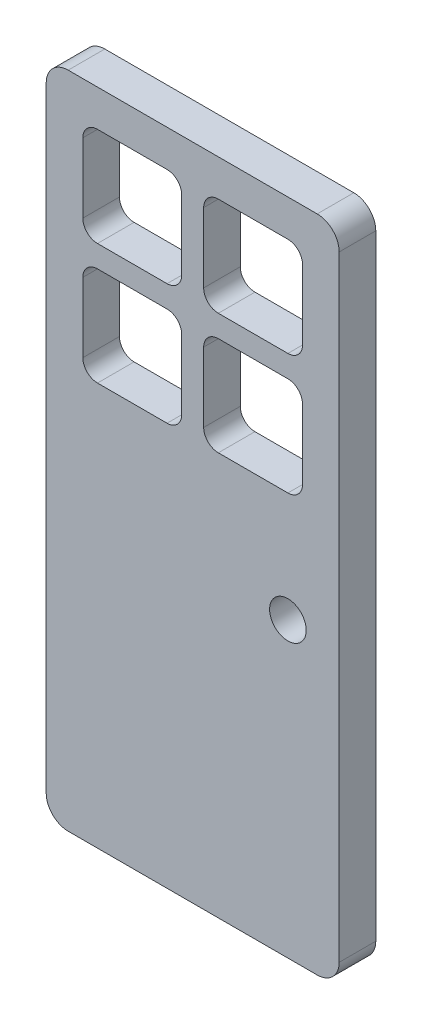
SolidWorks part; units mm, degrees
ref_plane "Front Plane" through (0, 0, 0) normal (0, 0, 1) x (1, 0, 0)
ref_plane "Top Plane" through (0, 0, 0) normal (0, 1, 0) x (1, 0, 0)
ref_plane "Right Plane" through (0, 0, 0) normal (1, 0, 0) x (0, 0, -1)
sketch "Sketch1" plane through (0, 0, 0) normal (0, 0, 1) x (1, 0, 0)
  line L1 (20, -45) -> (-20, -45)
  line L2 (20, -45) -> (20, 45)
  line L3 (20, 45) -> (-20, 45)
  line L4 (-20, -45) -> (-20, 45)
  line L5 (20, -45) -> (-20, 45) construction
  line L6 (20, 45) -> (-20, -45) construction
  point P0 (0, 0)
  dimension "D1" = 90
  dimension "D2" = 40
extrude "Boss-Extrude1" add sketch "Sketch1" along normal mid plane 5
fillet "Fillet1" radius 3 4 edges at (-20, -45, 0) (20, -45, 0) (20, 45, 0) (-20, 45, 0)
sketch "Sketch2" plane through (0, 0, 2.5) normal (0, 0, 1) x (1, 0, 0)
  line L0 (17, 45) -> (-17, 45) construction
  line L1 (15, 10) -> (-15, 10)
  line L2 (15, 10) -> (15, 40)
  line L3 (15, 40) -> (-15, 40)
  line L4 (-15, 10) -> (-15, 40)
  line L5 (15, 10) -> (-15, 40) construction
  line L6 (15, 40) -> (-15, 10) construction
  line L7 (-20, 42) -> (-20, -42) construction
  line L9 (0, 25) -> (0, 0) construction
  point P0 (0, 25)
  dimension "D1" = 5
  dimension "D2" = 5
  dimension "D3" = 30
extrude "Cut-Extrude1" cut sketch "Sketch2" against normal through all
sketch "Sketch3" plane through (0, 0, 2.5) normal (0, 0, 1) x (1, 0, 0)
  line L1 (15, 40) -> (-15, 40) construction
  line L2 (1.5, 10) -> (-1.5, 10)
  line L3 (1.5, 10) -> (1.5, 40)
  line L4 (1.5, 40) -> (-1.5, 40)
  line L7 (-1.5, 10) -> (-1.5, 40)
  line L8 (1.5, 10) -> (-1.5, 40) construction
  line L9 (1.5, 40) -> (-1.5, 10) construction
  line L10 (-15, 40) -> (-15, 10) construction
  line L12 (15, 23.5) -> (-15, 23.5)
  line L13 (15, 23.5) -> (15, 26.5)
  line L14 (15, 26.5) -> (-15, 26.5)
  line L15 (-15, 23.5) -> (-15, 26.5)
  line L16 (15, 23.5) -> (-15, 26.5) construction
  line L17 (15, 26.5) -> (-15, 23.5) construction
  point P0 (0, 25)
  point P7 (0, 25)
  dimension "D1" = 3
extrude "Boss-Extrude2" add sketch "Sketch3" against normal up to surface (5 mm away)
fillet "Fillet2" radius 2 16 edges at (15, 40, 0) (15, 26.5, 0) (15, 23.5, 0) (15, 10, 0) (1.5, 10, 0) (1.5, 23.5, 0) (1.5, 26.5, 0) (1.5, 40, 0) (-1.5, 40, 0) (-1.5, 23.5, 0) (-1.5, 26.5, 0) (-1.5, 10, 0) (-15, 10, 0) (-15, 23.5, 0) (-15, 40, 0) (-15, 26.5, 0)
sketch "Sketch4" plane through (0, 0, 2.5) normal (0, 0, 1) x (1, 0, 0)
  line L0 (3.5, 10) -> (13, 10) construction
  line L1 (13, 10) -> (13, -5) construction
  circle A0 centre (13, -5) radius 2.5
  arc A1 (13, 10) -> (15, 12) centre (13, 12) ccw construction
  dimension "D2" = 5
  dimension "D1" = 15
extrude "Cut-Extrude2" cut sketch "Sketch4" against normal through all
